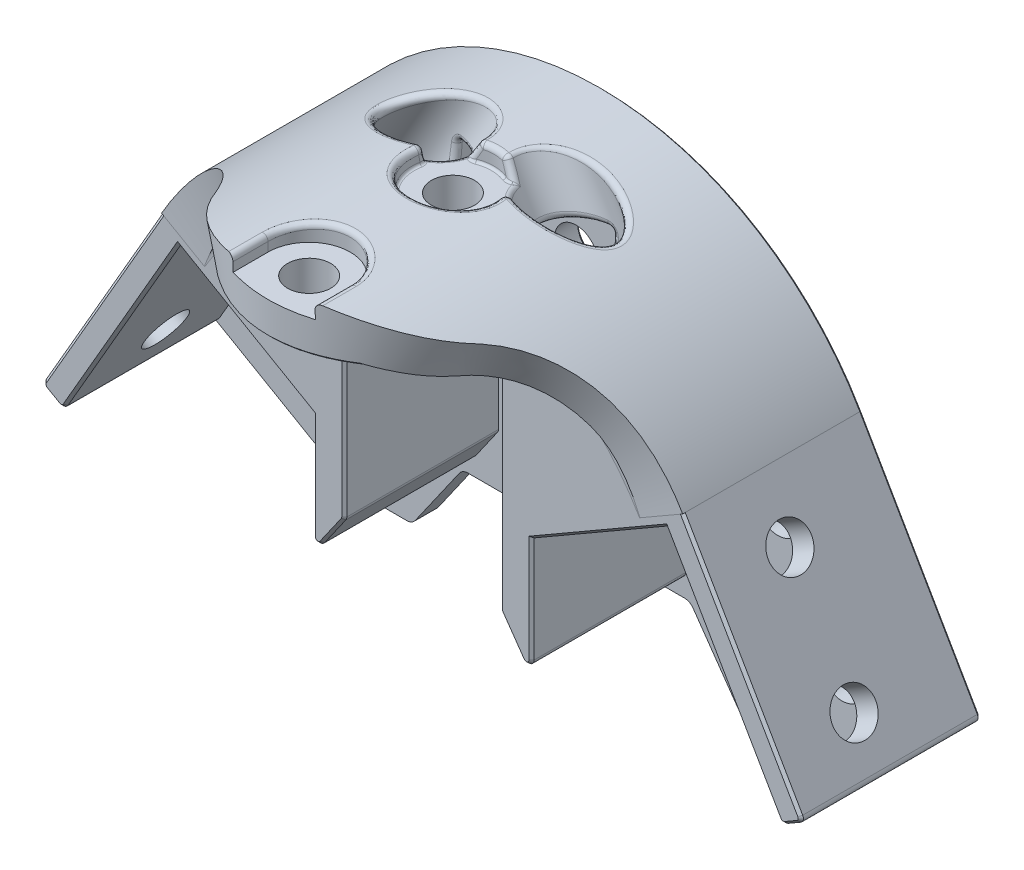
SolidWorks part; units mm, degrees
ref_plane "Płaszczyzna przednia" through (0, 0, 0) normal (0, 0, 1) x (1, 0, 0)
ref_plane "Płaszczyzna górna" through (0, 0, 0) normal (0, 1, 0) x (1, 0, 0)
ref_plane "Płaszczyzna prawa" through (0, 0, 0) normal (1, 0, 0) x (0, 0, -1)
sketch "Szkic2" plane through (0, 0, 0) normal (0, 0, 1) x (1, 0, 0)
  line L0 (0, 48.5816) -> (0, 18.2816) construction
  line L1 (-15.15, 48.5816) -> (15.15, 48.5816)
  line L2 (-15.15, 48.5816) -> (-15.15, 18.2816)
  line L3 (-15.15, 18.2816) -> (15.15, 18.2816)
  line L4 (15.15, 48.5816) -> (15.15, 18.2816)
  line L5 (0, 18.2816) -> (0, 10.2816) construction
  line L6 (0, 10.2816) -> (0, 0) construction
  line L8 (-74.1045, -11.1896) -> (-50.7331, 29.2908)
  line L9 (0, 48.5816) -> (0, 281.3446) construction
  line L10 (74.1045, -11.1896) -> (50.7331, 29.2908)
  line L12 (74.1045, -11.1896) -> (69.9476, -13.5896)
  line L13 (69.9476, -13.5896) -> (47.4476, 25.3816)
  line L14 (-74.1045, -11.1896) -> (-69.9476, -13.5896)
  line L16 (-69.9476, -13.5896) -> (-47.4476, 25.3816)
  line L17 (-47.4476, 25.3816) -> (-21.2936, 10.2816)
  line L20 (47.4476, 25.3816) -> (21.2936, 10.2816)
  line L27 (-21.2936, 10.2816) -> (21.2936, 10.2816)
  arc A0 (-50.7331, 29.2908) -> (50.7331, 29.2908) centre (0, 0) cw
  point P21 (0, 58.5816)
  dimension "D2" = 10
  dimension "D3" = 10
  dimension "D4" = 10
  dimension "D5" = 45
  dimension "D6" = 30.3
  dimension "D7" = 60
  dimension "D8" = 4.8
  dimension "D9" = 4.8
  dimension "D10" = 45
  dimension "D11" = 8
  dimension "D13" = 30.2
extrude "Dodanie-wyciągnięcie1" add sketch "Szkic2" along normal blind 30
sketch "Szkic3" plane through (0, 0, 30) normal (0, 0, 1) x (1, 0, 0)
  line L0 (15.15, 48.5816) -> (-15.15, 48.5816) construction
  line L1 (15.15, 48.5816) -> (-15.15, 48.5816)
  line L2 (-50.7331, 29.2908) -> (-44.0712, 25.4445)
  line L3 (44.0712, 25.4445) -> (50.7331, 29.2908)
  line L4 (-44.0712, 25.4445) -> (0, 0) construction
  line L5 (0, 0) -> (44.0712, 25.4445) construction
  arc A0 (50.7331, 29.2908) -> (-50.7331, 29.2908) centre (0, 0) ccw construction
  arc A1 (50.7331, 29.2908) -> (-50.7331, 29.2908) centre (0, 0) ccw
  arc A2 (-15.15, 48.5816) -> (-44.0712, 25.4445) centre (0, 0) ccw
  arc A3 (15.15, 48.5816) -> (44.0712, 25.4445) centre (0, 0) cw
extrude "Dodanie-wyciągnięcie2" add sketch "Szkic3" along normal blind 30
ref_plane "Płaszczyzna1" through (0, 58.5816, 0) normal (0, 1, 0) x (1, 0, 0)
sketch "Szkic4" plane through (0, 58.5816, 0) normal (0, 1, 0) x (1, 0, 0)
  line L0 (-50.7331, -30) -> (-74.1045, -30) construction
  line L1 (74.1045, -30) -> (50.7331, -30) construction
  line L3 (-50.7331, -60) -> (50.7331, -60) construction
  line L4 (-50.7331, -30) -> (-152.7515, -96.9535)
  line L5 (-152.7515, -96.9535) -> (111.6814, -96.9535)
  line L6 (111.6814, -96.9535) -> (50.7331, -30)
  arc A0 (-50.7331, -30) -> (-25.3666, -45) centre (-50.7331, -58.9488) cw
  arc A1 (50.7331, -30) -> (25.3666, -45) centre (50.7331, -58.9488) ccw
  arc A2 (-25.3666, -45) -> (25.3666, -45) centre (0, -31.0512) ccw
curve "Krzywa18"
ref_plane "Płaszczyzna2" through (0, 50.889, 0) normal (0, -1, 0) x (-1, 0, 0)
sketch "Szkic6" plane through (0, 50.889, 0) normal (0, -1, 0) x (-1, 0, 0)
  line L0 (-47.4476, -30) -> (-69.9476, -30) construction
  line L2 (69.9476, -30) -> (47.4476, -30) construction
  line L3 (-111.6814, -96.9535) -> (-44.0712, -30)
  line L4 (152.7515, -96.9535) -> (-111.6814, -96.9535)
  line L5 (44.0712, -30) -> (152.7515, -96.9535)
  line L9 (15.15, -60) -> (-15.15, -60) construction
  arc A3 (-22.0356, -45) -> (22.0356, -45) centre (0, -36.3144) ccw
  arc A4 (-22.0356, -45) -> (-44.0712, -30) centre (-44.0712, -53.6856) ccw
  arc A5 (44.0712, -30) -> (22.0356, -45) centre (44.0712, -53.6856) ccw
surface "Powierzchnia-Odsunięcie3" parameters "D1"=8
curve "Krzywa20"
surface "Powierzchnia-Wyciągnięcie po profilach2"
surface "Powierzchnia-Wydłuż2" parameters "D1"=2.1, "D2"=2.1
other "Przecięcie1"
sketch "Szkic36" plane through (0, 0, 30) normal (0, 0, 1) x (1, 0, 0)
  line L0 (-45.2565, 24.6508) -> (-44.5129, 25.6995)
  line L1 (-50.7331, 29.2908) -> (-44.0712, 25.4445) construction
  line L2 (-44.5129, 25.6995) -> (-41.1937, 23.9393)
  line L3 (-41.1937, 23.9393) -> (-42.2955, 22.7686)
  line L4 (-42.2955, 22.7686) -> (-45.2565, 24.6508)
  line L5 (44.2071, 25.2378) -> (41.6329, 23.9393)
  line L6 (41.6329, 23.9393) -> (42.293, 22.7214)
  line L7 (42.293, 22.7214) -> (44.9414, 24.2725)
  line L8 (44.9414, 24.2725) -> (44.2071, 25.2378)
extrude "Wytnij-wyciągnięcie9" cut sketch "Szkic36" against normal blind 1
sketch "Szkic37" plane through (0, 0, 29) normal (0, 0, 1) x (1, 0, 0)
  line L4 (44.9414, 24.2725) -> (44.2071, 25.2378)
  line L5 (44.2071, 25.2378) -> (41.6329, 23.9393)
  line L6 (41.6329, 23.9393) -> (42.293, 22.7214)
  line L7 (42.293, 22.7214) -> (44.9414, 24.2725)
  line L8 (44.9414, 24.2725) -> (44.2071, 25.2378)
  line L9 (44.2071, 25.2378) -> (41.6329, 23.9393)
  line L10 (41.6329, 23.9393) -> (42.293, 22.7214)
  line L11 (42.293, 22.7214) -> (44.9414, 24.2725)
  line L12 (-45.2565, 24.6508) -> (-42.2955, 22.7686)
  line L13 (-42.2955, 22.7686) -> (-41.1937, 23.9393)
  line L14 (-41.1937, 23.9393) -> (-44.5129, 25.6995)
  line L15 (-44.5129, 25.6995) -> (-45.2565, 24.6508)
  line L16 (-45.2565, 24.6508) -> (-42.2955, 22.7686)
  line L17 (-42.2955, 22.7686) -> (-41.1937, 23.9393)
  line L18 (-41.1937, 23.9393) -> (-44.5129, 25.6995)
  line L19 (-44.5129, 25.6995) -> (-45.2565, 24.6508)
  dimension "D1" = 0
  dimension "D2" = 0
extrude "Dodanie-wyciągnięcie5" add sketch "Szkic37" along normal blind 1
sketch "Szkic7" plane through (0, 0, 0) normal (0, 0, -1) x (-1, 0, 0)
  line L0 (-21.2936, 10.2816) -> (-43.7936, -28.6896)
  line L2 (-43.7936, -28.6896) -> (-69.9476, -13.5896)
  line L3 (-69.9476, -13.5896) -> (-74.1045, -11.1896) construction
  line L7 (69.9476, -13.5896) -> (43.7936, -28.6896)
  line L9 (69.9476, -13.5896) -> (74.1045, -11.1896)
  line L10 (74.1045, -11.1896) -> (50.7331, 29.2908)
  line L11 (-50.7331, 29.2908) -> (-74.1045, -11.1896)
  line L12 (-74.1045, -11.1896) -> (-69.9476, -13.5896)
  line L13 (-69.9476, -13.5896) -> (-47.4476, 25.3816)
  line L14 (-47.4476, 25.3816) -> (-21.2936, 10.2816)
  line L15 (-21.2936, 10.2816) -> (21.2936, 10.2816)
  line L16 (21.2936, 10.2816) -> (47.4476, 25.3816)
  line L17 (47.4476, 25.3816) -> (69.9476, -13.5896)
  line L18 (69.9476, -13.5896) -> (74.1045, -11.1896)
  line L19 (74.1045, -11.1896) -> (50.7331, 29.2908)
  line L20 (-50.7331, 29.2908) -> (-74.1045, -11.1896)
  line L21 (-74.1045, -11.1896) -> (-69.9476, -13.5896)
  line L24 (-21.2936, 10.2816) -> (21.2936, 10.2816)
  line L27 (43.7936, -28.6896) -> (21.2936, 10.2816)
  arc A1 (50.7331, 29.2908) -> (-50.7331, 29.2908) centre (0, 0) ccw
  arc A3 (50.7331, 29.2908) -> (-50.7331, 29.2908) centre (0, 0) ccw
  dimension "D2" = 35
  dimension "D3" = 35
  dimension "D1" = 0
extrude "Dodanie-wyciągnięcie3" add sketch "Szkic7" along normal blind 4
sketch "Szkic8" plane through (0, 0, 0) normal (0, 0, 1) x (1, 0, 0)
  line L0 (-56.784, -21.1896) -> (-34.284, 17.7816) construction
  line L1 (-43.7936, -28.6896) -> (-69.9476, -13.5896) construction
  line L2 (-47.4476, 25.3816) -> (-21.2936, 10.2816) construction
  line L3 (-21.2936, 10.2816) -> (-43.7936, -28.6896) construction
  line L4 (-15.15, 48.5816) -> (15.15, 18.2816) construction
  line L5 (56.784, -21.1896) -> (34.284, 17.7816) construction
  line L6 (69.9476, -13.5896) -> (43.7936, -28.6896) construction
  line L7 (21.2936, 10.2816) -> (47.4476, 25.3816) construction
  line L8 (43.7936, -28.6896) -> (21.2936, 10.2816) construction
  line L9 (21.2936, 10.2816) -> (47.4476, 25.3816) construction
  point P20 (-39.8236, 128.4719)
  point P21 (-39.284, 9.1213)
  point P22 (-51.784, -12.5293)
  point P23 (39.284, 9.1213)
  point P24 (51.784, -12.5293)
  point P27 (0, 33.4316)
  dimension "D1" = 15
  dimension "D2" = 15
  dimension "D3" = 10
  dimension "D4" = 10
  dimension "D5" = 10
  dimension "D6" = 10
hole_wizard "Otwór pod śrubę M81" positions "Szkic9" profile "Szkic10" hole size "M8" standard "DIN"
sketch "Szkic9" plane through (0, 0, 0) normal (0, 0, 1) x (1, 0, 0)
  point P0 (0, 33.4316)
  point P3 (-39.284, 9.1213)
  point P6 (-51.784, -12.5293)
  point P9 (39.284, 9.1213)
  point P12 (51.784, -12.5293)
sketch "Szkic10" plane through (0, 33.4316, 0) normal (1, 0, 0) x (0, -1, 0)
  line L0 (0, 0) -> (0, 4)
  line L1 (0, 4) -> (4.2, 4)
  line L2 (4.2, 4) -> (4.2, 0)
  line L5 (4.2, 0) -> (0, 0)
  line L11 (0, -6.35) -> (0, 107.95) construction
  dimension "Średnica otworu na wylot" = 8.4
  dimension "Głębokość otworu na wylot" = 4
sketch "Szkic11" plane through (-46.5762, 26.8908, 0) normal (0.866, -0.5, 0) x (0, 0, -1)
  line L0 (-15, -1.7427) -> (-15, -46.7427) construction
  line L1 (-30, -1.7427) -> (0, -1.7427) construction
  line L2 (-30, -46.7427) -> (0, -46.7427) construction
  line L3 (-30, -1.7427) -> (0, -1.7427) construction
  point P6 (-15, -11.7427)
  point P7 (-15, -36.7427)
  dimension "D1" = 10
  dimension "D2" = 10
hole_wizard "Otwór pod śrubę M82" positions "Szkic12" profile "Szkic13" hole size "M8" standard "DIN"
sketch "Szkic12" plane through (-46.5762, 26.8908, 0) normal (0.866, -0.5, 0) x (0, 0, -1)
  point P0 (-15, -11.7427)
  point P3 (-15, -36.7427)
sketch "Szkic13" plane through (-52.4476, 16.7213, 15) normal (0, 0, 1) x (0.5, 0.866, 0)
  line L0 (0, 0) -> (0, 39.6856)
  line L1 (0, 39.6856) -> (4.2, 39.6856)
  line L2 (4.2, 39.6856) -> (4.2, 0)
  line L5 (4.2, 0) -> (0, 0)
  line L11 (0, -6.35) -> (0, 107.95) construction
  dimension "Średnica otworu na wylot" = 8.4
  dimension "Głębokość otworu na wylot" = 39.6856
sketch "Szkic14" plane through (46.5762, 26.8908, 0) normal (-0.866, -0.5, 0) x (0, 0, 1)
  line L0 (15, -1.7427) -> (15, -46.7427) construction
  line L1 (30, -1.7427) -> (0, -1.7427) construction
  line L2 (30, -46.7427) -> (0, -46.7427) construction
  point P6 (15, -11.7427)
  point P7 (15, -36.7427)
  dimension "D1" = 10
  dimension "D2" = 10
hole_wizard "Otwór pod śrubę M83" positions "Szkic15" profile "Szkic16" hole size "M8" standard "DIN"
sketch "Szkic15" plane through (46.5762, 26.8908, 0) normal (-0.866, -0.5, 0) x (0, 0, 1)
  point P0 (15, -11.7427)
  point P3 (15, -36.7427)
sketch "Szkic16" plane through (52.4476, 16.7213, 15) normal (0, 0, 1) x (0.5, -0.866, 0)
  line L0 (0, 0) -> (0, 39.6856)
  line L1 (0, 39.6856) -> (4.2, 39.6856)
  line L2 (4.2, 39.6856) -> (4.2, 0)
  line L5 (4.2, 0) -> (0, 0)
  line L11 (0, -6.35) -> (0, 107.95) construction
  dimension "Średnica otworu na wylot" = 8.4
  dimension "Głębokość otworu na wylot" = 39.6856
sketch "Szkic17" plane through (0, 18.2816, 0) normal (0, 1, 0) x (1, 0, 0)
  line L0 (-15.15, 0) -> (15.15, -30)
  point P4 (0, -15)
hole_wizard "Otwór pod śrubę M84" positions "Szkic20" profile "Szkic21" hole size "M8" standard "DIN"
sketch "Szkic20" plane through (0, 18.2816, 0) normal (0, 1, 0) x (1, 0, 0)
  point P0 (0, -15)
sketch "Szkic21" plane through (0, 18.2816, 15) normal (1, 0, 0) x (0, 0, 1)
  line L0 (0, 0) -> (0, 46.9711)
  line L1 (0, 46.9711) -> (4.2, 46.9711)
  line L2 (4.2, 46.9711) -> (4.2, 0)
  line L5 (4.2, 0) -> (0, 0)
  line L11 (0, -6.35) -> (0, 107.95) construction
  dimension "Średnica otworu na wylot" = 8.4
  dimension "Głębokość otworu na wylot" = 46.9711
sketch "Szkic38" plane through (0, 48.5816, 0) normal (0, -1, 0) x (1, 0, 0)
  line L0 (0, 52) -> (0, 24)
  line L1 (-48.3329, 60) -> (51.7441, 60) construction
  spline S0 degree 3 poles (-1281.8202, 1578.8529) (185.3728, -818.5402) (-121.0759, -4.4194) (-10.5468, 57.4983) (-9.3105, 58.0736) (-7.3727, 58.7856) (-6.7193, 58.9954) (-5.4068, 59.3564) (-4.7462, 59.5082) (-2.7511, 59.8741) (-1.403, 59.9978) (0.6466, 60.0011) (1.3383, 59.9699) (2.7049, 59.8457) (3.3813, 59.7531) (5.391, 59.3886) (6.7047, 59.0298) (8.6369, 58.3215) (9.2754, 58.0566) (10.5199, 57.4815) (11.1287, 57.1705) (118.6979, -2.974) (-185.8037, -776.5369) (1303.6672, 1561.7558) knots -11.391048 -11.391048 -11.391048 -11.391048 0.125 0.125 0.25 0.25 0.3125 0.3125 0.375 0.375 0.5 0.5 0.5625 0.5625 0.625 0.625 0.75 0.75 0.8125 0.8125 0.875 0.875 12.094098 12.094098 12.094098 12.094098 only from (-15.15, 54.5778) to (15.15, 54.5776) construction
  spline S1 degree 3 poles (-15.15, 54.5778) (-14.0583, 55.415) (-12.9205, 56.1686) (-10.5468, 57.4983) (-9.3105, 58.0736) (-7.3727, 58.7856) (-6.7193, 58.9954) (-5.4068, 59.3564) (-4.7462, 59.5082) (-2.7511, 59.8741) (-1.403, 59.9978) (0.6466, 60.0011) (1.3383, 59.9699) (2.7049, 59.8457) (3.3813, 59.7531) (5.391, 59.3886) (6.7047, 59.0298) (8.6369, 58.3215) (9.2754, 58.0566) (10.5199, 57.4815) (11.1287, 57.1705) (12.9165, 56.1709) (14.0572, 55.4159) (15.15, 54.5776) knots 0 0 0 0 0.125 0.125 0.25 0.25 0.3125 0.3125 0.375 0.375 0.5 0.5 0.5625 0.5625 0.625 0.625 0.75 0.75 0.8125 0.8125 0.875 0.875 1 1 1 1
  dimension "D1" = 8
  dimension "D2" = 28
hole_wizard "Otwór pod śrubę M88" positions "Szkic39" profile "Szkic40" hole size "M8" standard "DIN"
sketch "Szkic39" plane through (0, 48.5816, 0) normal (0, -1, 0) x (-1, 0, 0)
  point P0 (0, -52)
  point P3 (0, -24)
sketch "Szkic40" plane through (0, 48.5816, 52) normal (1, 0, 0) x (0, 0, -1)
  line L0 (0, 0) -> (0, 10)
  line L1 (0, 10) -> (4.2, 10)
  line L2 (4.2, 10) -> (4.2, 0)
  line L5 (4.2, 0) -> (0, 0)
  line L11 (0, -6.35) -> (0, 107.95) construction
  dimension "Średnica otworu na wylot" = 8.4
  dimension "Głębokość otworu na wylot" = 10
ref_plane "Płaszczyzna3" through (0, 55.0816, 0) normal (0, -1, 0) x (-1, 0, 0)
sketch "Szkic41" plane through (0, 55.0816, 0) normal (0, -1, 0) x (-1, 0, 0)
  line L0 (0, -52) -> (0, -59.9999) construction
  line L1 (8, -52) -> (8, -59.9999)
  line L2 (-8, -52) -> (-8, -59.9999)
  circle A0 centre (0, -24) radius 8
  arc A1 (8, -52) -> (-8, -52) centre (0, -52) ccw
  arc A2 (-8, -59.9999) -> (8, -59.9999) centre (0, -59.9999) ccw
  spline S0 degree 3 number of poles 90 (50.7331, -30) -> (-50.7331, -30) construction
  point P9 (0, -56)
  dimension "D1" = 16
extrude "Wytnij-wyciągnięcie11" cut sketch "Szkic41" against normal through all
sketch "Szkic25" plane through (-0.8713, -1.5092, 0) normal (-0.5, -0.866, 0) x (0.866, -0.5, 0)
  line L0 (-53.5816, 30) -> (-53.5816, 0) construction
  line L1 (-53.7816, 30) -> (-23.5816, 30) construction
  line L2 (-53.7816, 0) -> (-23.5816, 0) construction
  line L4 (-23.5816, 30) -> (-23.5816, 0) construction
  line L5 (-53.5816, 30) -> (-23.5816, 0) construction
  point P8 (-38.5816, 15)
  dimension "D1" = 30
sketch "Szkic26" plane through (0.8713, -1.5092, 0) normal (0.5, -0.866, 0) x (0.866, 0.5, 0)
  line L0 (53.5816, 30) -> (53.5816, 0) construction
  line L1 (23.5816, 30) -> (53.7816, 30) construction
  line L2 (23.5816, 0) -> (53.7816, 0) construction
  line L3 (23.5816, 30) -> (23.5816, 0) construction
  line L4 (53.5816, 30) -> (23.5816, 0)
  point P8 (38.5816, 15)
  dimension "D1" = 30
hole_wizard "Otwór pod śrubę M86" positions "Szkic27" profile "Szkic28" hole size "M8" standard "DIN"
sketch "Szkic27" plane through (0.8713, -1.5092, 0) normal (0.5, -0.866, 0) x (-0.866, -0.5, 0)
  point P0 (-38.5816, -15)
sketch "Szkic28" plane through (34.284, 17.7816, 15) normal (0, 0, 1) x (0.866, 0.5, 0)
  line L0 (0, 0) -> (0, 89.5281)
  line L1 (0, 89.5281) -> (4.2, 89.5281)
  line L2 (4.2, 89.5281) -> (4.2, 0)
  line L5 (4.2, 0) -> (0, 0)
  line L11 (0, -6.35) -> (0, 107.95) construction
  dimension "Średnica otworu na wylot" = 8.4
  dimension "Głębokość otworu na wylot" = 89.5281
hole_wizard "Otwór pod śrubę M87" positions "Szkic29" profile "Szkic30" hole size "M8" standard "DIN"
sketch "Szkic29" plane through (-0.8713, -1.5092, 0) normal (-0.5, -0.866, 0) x (-0.866, 0.5, 0)
  point P0 (38.5816, -15)
sketch "Szkic30" plane through (-34.284, 17.7816, 15) normal (0, 0, 1) x (0.866, -0.5, 0)
  line L0 (0, 0) -> (0, 89.5281)
  line L1 (0, 89.5281) -> (4.2, 89.5281)
  line L2 (4.2, 89.5281) -> (4.2, 0)
  line L5 (4.2, 0) -> (0, 0)
  line L11 (0, -6.35) -> (0, 107.95) construction
  dimension "Średnica otworu na wylot" = 8.4
  dimension "Głębokość otworu na wylot" = 89.5281
ref_plane "Płaszczyzna4" through (3.1287, 5.419, 0) normal (-0.5, -0.866, 0) x (-0.866, 0.5, 0)
ref_plane "Płaszczyzna5" through (-3.1287, 5.419, 0) normal (0.5, -0.866, 0) x (-0.866, -0.5, 0)
sketch "Szkic31" plane through (3.1287, 5.419, 0) normal (-0.5, -0.866, 0) x (-0.866, 0.5, 0)
  circle A0 centre (38.5816, -15) radius 7
  dimension "D1" = 14
extrude "Wytnij-wyciągnięcie3" cut sketch "Szkic31" against normal through all
sketch "Szkic32" plane through (-3.1287, 5.419, 0) normal (0.5, -0.866, 0) x (-0.866, -0.5, 0)
  circle A0 centre (-38.5816, -15) radius 7
  dimension "D1" = 14
extrude "Wytnij-wyciągnięcie4" cut sketch "Szkic32" against normal through all
sketch "Szkic33" plane through (0, 0, 0) normal (0, 0, 1) x (1, 0, 0)
  line L0 (-15.15, 18.2816) -> (15.15, 18.2816) construction
  line L1 (-15.15, 18.2816) -> (15.15, 18.2816)
  line L2 (-15.15, 18.2816) -> (-15.15, 10.2816)
  line L3 (-15.15, 10.2816) -> (15.15, 10.2816)
  line L4 (15.15, 18.2816) -> (15.15, 10.2816)
  line L5 (-21.2936, 10.2816) -> (21.2936, 10.2816) construction
  line L6 (0, 18.2816) -> (0, 33.4316) construction
  dimension "D1" = 30.3
extrude "Wytnij-wyciągnięcie7" cut sketch "Szkic33" against normal through all both and the other way through all
sketch "Szkic42" plane through (0, 0, -4) normal (0, 0, -1) x (-1, 0, 0)
  line L0 (15.15, 10.2816) -> (15.15, -4.7184)
  line L1 (15.15, -4.7184) -> (31.9348, -28.6896)
  line L2 (31.9348, -28.6896) -> (43.7936, -28.6896)
  line L3 (43.7936, -28.6896) -> (21.2936, 10.2816)
  line L4 (21.2936, 10.2816) -> (15.15, 10.2816)
  line L5 (0, 33.4316) -> (0, -49.4461) construction
  line L6 (-21.2936, 10.2816) -> (-15.15, 10.2816)
  line L7 (-43.7936, -28.6896) -> (-21.2936, 10.2816)
  line L8 (-31.9348, -28.6896) -> (-43.7936, -28.6896)
  line L9 (-15.15, -4.7184) -> (-31.9348, -28.6896)
  line L10 (-15.15, 10.2816) -> (-15.15, -4.7184)
  dimension "D1" = 145
  dimension "D2" = 15
extrude "Dodanie-wyciągnięcie6" add sketch "Szkic42" against normal up to surface (4 mm away)
sketch "Szkic43" plane through (0, 0, 0) normal (0, 0, 1) x (1, 0, 0)
  line L0 (15.15, 10.2816) -> (21.2936, 10.2816) construction
  line L1 (-15.15, 10.2816) -> (-21.2936, 10.2816) construction
  line L2 (15.15, 10.2816) -> (21.2936, 10.2816)
  line L3 (-15.15, 10.2816) -> (-21.2936, 10.2816)
  line L4 (-15.15, 10.2816) -> (-15.15, -4.7184)
  line L5 (-15.15, -4.7184) -> (-21.2936, -13.4924)
  line L6 (-31.9348, -28.6896) -> (-15.15, -4.7184) construction
  line L7 (-21.2936, -13.4924) -> (-21.2936, 10.2816)
  line L8 (15.15, 10.2816) -> (15.15, -4.7184)
  line L9 (15.15, -4.7184) -> (21.2936, -13.4924)
  line L10 (15.15, -4.7184) -> (31.9348, -28.6896) construction
  line L11 (21.2936, -13.4924) -> (21.2936, 10.2816)
extrude "Dodanie-wyciągnięcie7" add sketch "Szkic43" along normal up to surface (30 mm away)
sketch "Szkic44" plane through (15.15, 0, 0) normal (-1, 0, 0) x (0, 0, 1)
  circle A2 centre (22.3426, 7.3116) radius 2.5
  circle A3 centre (22.3426, 7.3116) radius 7.5
sketch "Szkic45" plane through (0, 0, -4) normal (0, 0, -1) x (-1, 0, 0)
  line L0 (15.15, -4.7184) -> (15.15, 18.2816) construction
  line L1 (15.15, 18.2816) -> (-15.15, 18.2816) construction
  line L2 (-15.15, 18.2816) -> (-15.15, -4.7184) construction
  line L3 (15.15, -4.7184) -> (15.15, 18.2816)
  line L4 (15.15, 18.2816) -> (-15.15, 18.2816)
  line L5 (-15.15, 18.2816) -> (-15.15, -4.7184)
  line L8 (-22.1521, -14.7184) -> (22.1521, -14.7184)
  line L9 (-31.9348, -28.6896) -> (-15.15, -4.7184) construction
  line L10 (15.15, -4.7184) -> (31.9348, -28.6896) construction
  line L11 (15.15, -4.7184) -> (22.1521, -14.7184)
  line L12 (-22.1521, -14.7184) -> (-15.15, -4.7184)
  dimension "D1" = 33
extrude "Dodanie-wyciągnięcie8" add sketch "Szkic45" against normal up to surface (4 mm away)
sketch "Szkic49" plane through (0, 0, -4) normal (0, 0, -1) x (-1, 0, 0)
  line L120 (-5.1, 47.6816) -> (-5.1, 48.4316)
  line L121 (-5.1, 48.4316) -> (-13, 48.4316)
  line L122 (-15, 46.4316) -> (-15, 38.5316)
  line L123 (-15, 38.5316) -> (-14.25, 38.5316)
  line L124 (-14.25, 38.5316) -> (-14.25, 37.5316)
  line L125 (-14.25, 37.5316) -> (-13.5, 37.5316)
  line L126 (-13.5, 37.5316) -> (-13.5, 41.1816)
  line L127 (-13, 41.6816) -> (-9.5178, 41.6816)
  line L128 (-9.1642, 41.5351) -> (-5.9464, 38.3174)
  line L129 (-5.8, 37.9638) -> (-5.8, 28.8994)
  line L130 (-5.9464, 28.5458) -> (-9.1642, 25.328)
  line L131 (-9.5178, 25.1816) -> (-13, 25.1816)
  line L132 (-13.5, 25.6816) -> (-13.5, 29.3316)
  line L133 (-13.5, 29.3316) -> (-14.25, 29.3316)
  line L134 (-14.25, 29.3316) -> (-14.25, 28.3316)
  line L135 (-14.25, 28.3316) -> (-15, 28.3316)
  line L136 (-15, 28.3316) -> (-15, 20.4316)
  line L137 (-13, 18.4316) -> (-5.1, 18.4316)
  line L138 (-5.1, 18.4316) -> (-5.1, 19.1816)
  line L139 (-5.1, 19.1816) -> (-4.1, 19.1816)
  line L140 (-4.1, 19.1816) -> (-4.1, 19.9316)
  line L141 (-4.1, 19.9316) -> (-7.75, 19.9316)
  line L142 (-8.25, 20.4316) -> (-8.25, 23.9138)
  line L143 (-8.1036, 24.2674) -> (-4.8858, 27.4851)
  line L144 (-4.5322, 27.6316) -> (4.5322, 27.6316)
  line L145 (4.8858, 27.4851) -> (8.1036, 24.2674)
  line L146 (8.25, 23.9138) -> (8.25, 20.4316)
  line L147 (7.75, 19.9316) -> (4.1, 19.9316)
  line L148 (4.1, 19.9316) -> (4.1, 19.1816)
  line L149 (4.1, 19.1816) -> (5.1, 19.1816)
  line L150 (5.1, 19.1816) -> (5.1, 18.4316)
  line L151 (5.1, 18.4316) -> (13, 18.4316)
  line L152 (15, 20.4316) -> (15, 28.3316)
  line L153 (15, 28.3316) -> (14.25, 28.3316)
  line L154 (14.25, 28.3316) -> (14.25, 29.3316)
  line L155 (14.25, 29.3316) -> (13.5, 29.3316)
  line L156 (13.5, 29.3316) -> (13.5, 25.6816)
  line L157 (13, 25.1816) -> (9.5178, 25.1816)
  line L158 (9.1642, 25.328) -> (5.9464, 28.5458)
  line L159 (5.8, 28.8994) -> (5.8, 37.9638)
  line L160 (5.9464, 38.3174) -> (9.1642, 41.5351)
  line L161 (9.5178, 41.6816) -> (13, 41.6816)
  line L162 (13.5, 41.1816) -> (13.5, 37.5316)
  line L163 (13.5, 37.5316) -> (14.25, 37.5316)
  line L164 (14.25, 37.5316) -> (14.25, 38.5316)
  line L165 (14.25, 38.5316) -> (15, 38.5316)
  line L166 (15, 38.5316) -> (15, 46.4316)
  line L167 (13, 48.4316) -> (5.1, 48.4316)
  line L168 (5.1, 48.4316) -> (5.1, 47.6816)
  line L169 (5.1, 47.6816) -> (4.1, 47.6816)
  line L170 (4.1, 47.6816) -> (4.1, 46.9316)
  line L171 (4.1, 46.9316) -> (7.75, 46.9316)
  line L172 (8.25, 46.4316) -> (8.25, 42.9494)
  line L173 (8.1036, 42.5958) -> (4.8858, 39.378)
  line L174 (4.5322, 39.2316) -> (-4.5322, 39.2316)
  line L175 (-4.8858, 39.378) -> (-8.1036, 42.5958)
  line L176 (-8.25, 42.9494) -> (-8.25, 46.4316)
  line L177 (-7.75, 46.9316) -> (-4.1, 46.9316)
  line L178 (-4.1, 46.9316) -> (-4.1, 47.6816)
  line L179 (-4.1, 47.6816) -> (-5.1, 47.6816)
  arc A56 (-13, 48.4316) -> (-15, 46.4316) centre (-13, 46.4316) ccw
  arc A57 (-13, 41.6816) -> (-13.5, 41.1816) centre (-13, 41.1816) ccw
  arc A58 (-9.1642, 41.5351) -> (-9.5178, 41.6816) centre (-9.5178, 41.1816) ccw
  arc A59 (-5.8, 37.9638) -> (-5.9464, 38.3174) centre (-6.3, 37.9638) ccw
  arc A60 (-5.9464, 28.5458) -> (-5.8, 28.8994) centre (-6.3, 28.8994) ccw
  arc A61 (-9.5178, 25.1816) -> (-9.1642, 25.328) centre (-9.5178, 25.6816) ccw
  arc A62 (-13.5, 25.6816) -> (-13, 25.1816) centre (-13, 25.6816) ccw
  arc A63 (-15, 20.4316) -> (-13, 18.4316) centre (-13, 20.4316) ccw
  arc A64 (-8.25, 20.4316) -> (-7.75, 19.9316) centre (-7.75, 20.4316) ccw
  arc A65 (-8.1036, 24.2674) -> (-8.25, 23.9138) centre (-7.75, 23.9138) ccw
  arc A66 (-4.5322, 27.6316) -> (-4.8858, 27.4851) centre (-4.5322, 27.1316) ccw
  arc A67 (4.8858, 27.4851) -> (4.5322, 27.6316) centre (4.5322, 27.1316) ccw
  arc A68 (8.25, 23.9138) -> (8.1036, 24.2674) centre (7.75, 23.9138) ccw
  arc A69 (7.75, 19.9316) -> (8.25, 20.4316) centre (7.75, 20.4316) ccw
  arc A70 (13, 18.4316) -> (15, 20.4316) centre (13, 20.4316) ccw
  arc A71 (13, 25.1816) -> (13.5, 25.6816) centre (13, 25.6816) ccw
  arc A72 (9.1642, 25.328) -> (9.5178, 25.1816) centre (9.5178, 25.6816) ccw
  arc A73 (5.8, 28.8994) -> (5.9464, 28.5458) centre (6.3, 28.8994) ccw
  arc A74 (5.9464, 38.3174) -> (5.8, 37.9638) centre (6.3, 37.9638) ccw
  arc A75 (9.5178, 41.6816) -> (9.1642, 41.5351) centre (9.5178, 41.1816) ccw
  arc A76 (13.5, 41.1816) -> (13, 41.6816) centre (13, 41.1816) ccw
  arc A77 (15, 46.4316) -> (13, 48.4316) centre (13, 46.4316) ccw
  arc A78 (8.25, 46.4316) -> (7.75, 46.9316) centre (7.75, 46.4316) ccw
  arc A79 (8.1036, 42.5958) -> (8.25, 42.9494) centre (7.75, 42.9494) ccw
  arc A80 (4.5322, 39.2316) -> (4.8858, 39.378) centre (4.5322, 39.7316) ccw
  arc A81 (-4.8858, 39.378) -> (-4.5322, 39.2316) centre (-4.5322, 39.7316) ccw
  arc A82 (-8.25, 42.9494) -> (-8.1036, 42.5958) centre (-7.75, 42.9494) ccw
  arc A83 (-7.75, 46.9316) -> (-8.25, 46.4316) centre (-7.75, 46.4316) ccw
sketch "Szkic50" plane through (0, 0, -4) normal (0, 0, -1) x (-1, 0, 0)
  circle A1 centre (0, 7.3316) radius 2.7
  dimension "D1" = 5.4
extrude "Wytnij-wyciągnięcie14" cut sketch "Szkic50" against normal through all
sketch "Szkic51" plane through (0, 0, -4) normal (0, 0, -1) x (-1, 0, 0)
  line L9 (-22.1521, -14.7184) -> (22.1521, -14.7184)
  line L10 (22.1521, -14.7184) -> (31.9348, -28.6896)
  line L11 (31.9348, -28.6896) -> (43.7936, -28.6896)
  line L12 (43.7936, -28.6896) -> (74.1045, -11.1896)
  line L13 (74.1045, -11.1896) -> (50.7331, 29.2908)
  line L14 (-50.7331, 29.2908) -> (-74.1045, -11.1896)
  line L15 (-74.1045, -11.1896) -> (-43.7936, -28.6896)
  line L16 (-43.7936, -28.6896) -> (-31.9348, -28.6896)
  line L17 (-31.9348, -28.6896) -> (-22.1521, -14.7184)
  line L18 (-22.1521, -14.7184) -> (22.1521, -14.7184)
  line L19 (22.1521, -14.7184) -> (31.9348, -28.6896)
  line L20 (31.9348, -28.6896) -> (43.7936, -28.6896)
  line L21 (43.7936, -28.6896) -> (74.1045, -11.1896)
  line L22 (74.1045, -11.1896) -> (50.7331, 29.2908)
  line L23 (-50.7331, 29.2908) -> (-74.1045, -11.1896)
  line L24 (-74.1045, -11.1896) -> (-43.7936, -28.6896)
  line L25 (-43.7936, -28.6896) -> (-31.9348, -28.6896)
  line L26 (-31.9348, -28.6896) -> (-22.1521, -14.7184)
  arc A1 (50.7331, 29.2908) -> (-50.7331, 29.2908) centre (0, 0) ccw
  arc A2 (50.7331, 29.2908) -> (-50.7331, 29.2908) centre (0, 0) ccw
  circle A3 centre (-51.784, -12.5293) radius 4.2
  circle A4 centre (-51.784, -12.5293) radius 4.2
  circle A5 centre (-39.284, 9.1213) radius 4.2
  circle A6 centre (-39.284, 9.1213) radius 4.2
  circle A7 centre (51.784, -12.5293) radius 4.2
  circle A8 centre (51.784, -12.5293) radius 4.2
  circle A9 centre (39.284, 9.1213) radius 4.2
  circle A10 centre (39.284, 9.1213) radius 4.2
  circle A11 centre (0, 33.4316) radius 4.2
  circle A12 centre (0, 33.4316) radius 4.2
  circle A13 centre (0, 7.3316) radius 2.7
  circle A14 centre (0, 7.3316) radius 2.7
  dimension "D1" = 0
  dimension "D2" = 0
  dimension "D3" = 0
  dimension "D4" = 0
  dimension "D5" = 0
  dimension "D6" = 0
  dimension "D7" = 0
extrude "Dodanie-wyciągnięcie9" add sketch "Szkic51" along normal blind 1
fillet "Zaokrąglenie1" radius 1 10 edges at (-15.15, 48.5816, 4.0493) (15.15, 48.5816, 4.0493) (74.1045, -11.1896, 12.5) (69.9476, -13.5896, 15) (-15.15, -4.7184, 15) (15.15, -4.7184, 15) (21.2936, -13.4924, 15) (-21.2936, -13.4924, 15) (-69.9476, -13.5896, 15) (-74.1045, -11.1896, 12.5)
fillet "Zaokrąglenie2" radius 1 13 edges at (-8, 58.0328, 55.4362) (8, 58.0328, 55.4362) (8.435, 48.5816, 15.4449) (14.7692, 48.3668, 8.1871) (-15.15, 36.9319, 15.2553) (-14.9406, 48.1939, 8.1728) (0.9129, 58.5745, 31.9477) (0.9129, 58.5745, 31.9477) (0.9129, 58.5745, 59.9477) (-4.0419, 58.442, 18.8286) (4.9396, 58.373, 19.7763) (15.15, 36.9319, 15.2553) (-8.435, 48.5816, 15.4449)
fillet "Zaokrąglenie3" radius 1 8 edges at (2.7371, 58.362, 15.9763) (-2.7349, 58.3632, 15.9737) (-7.891, 57.6515, 21.4431) (7.8862, 57.6486, 21.4385) (4.538, 56.1602, 17.4116) (-4.7761, 55.878, 17.5821) (-7.0588, 55.6434, 20.2352) (7.0623, 55.6523, 20.2418)
fillet "Zaokrąglenie4" radius 1 2 edges at (6.1334, 55.0816, 19.0221) (-6.1334, 55.0816, 19.0221)
fillet "Zaokrąglenie5" radius 0.5 10 edges at (-4.5791, 55.0228, 16.4136) (-3.6501, 55.0816, 16.7634) (4.5791, 55.0228, 16.4136) (3.8497, 55.0816, 16.7573) (8.5228, 54.9161, 21.2052) (7.8359, 55.0816, 22.0818) (-8.5228, 54.9161, 21.2052) (-7.8742, 55.0816, 21.9121) (0, 55.0816, 16) (0, 55.0816, 32)
fillet "Zaokrąglenie6" radius 2 11 edges at (43.7936, -28.6896, -2.5) (-43.7936, -28.6896, -2.5) (-31.7902, 39.7376, 30) (31.7902, 39.7376, 30) (44.0712, 25.4445, 30.0007) (-44.0712, 25.4445, 30.0007) (-31.9348, -28.6896, -2.5) (31.9348, -28.6896, -2.5) (-22.1521, -14.7184, -2.5) (22.1521, -14.7184, -2.5) (29.8992, 41.1792, 34.8528)
chamfer "Sfazowanie1" distance 0.5 angle 45 56 edges at (15.15, 48.5816, 43.2888) (-15.15, 48.5816, 43.2889) (-15.15, 48.5816, 27.4971) (15.15, 48.5816, 27.4971) (-34.3706, 17.8316, 30) (34.3706, 17.8316, 30) (21.2936, -0.0196, 30) (58.4476, 6.329, 30) (0, 58.5816, -5) (62.1688, 9.4836, -5) (47.584, -12.5293, -5) (35.084, 9.1213, -5) (-55.984, -12.5293, -5) (-43.484, 9.1213, -5) (-4.2, 33.4316, -5) (-2.7, 7.3316, -5) (15.15, 21.0396, 30) (-62.1688, 9.4836, -5) (58.7481, -20.0556, -5) (-73.7044, -11.0824, -5) (73.7044, -11.0824, -5) (72.026, -12.3896, 30) (17.4026, -7.9355, 30) (20.5943, -11.2745, 30) (15.1963, -4.7038, 30) (70.0548, -13.1895, 30) (73.7044, -11.0824, 30) (-17.4026, -7.9355, 30) (-21.2936, -0.0196, 30) (-72.026, -12.3896, 30) (-58.4476, 6.329, 30) (-73.7044, -11.0824, 30) (-70.0548, -13.1895, 30) (-20.5943, -11.2745, 30) (-15.1963, -4.7038, 30) (1.1917, 48.5816, 59.9679) (38.1168, -28.6896, -5) (27.0434, -21.704, -5) (0, -14.7184, -5) (-27.0434, -21.704, -5) (-38.1168, -28.6896, -5) (-58.7481, -20.0556, -5) (-43.7753, -28.6214, -5) (32.0524, -28.4636, -5) (-32.0524, -28.4636, -5) (43.7753, -28.6214, -5) (25.6005, 43.9808, 32) (-15.15, 21.0396, 30) (-30.7842, 37.9799, 30) (22.0344, -14.9444, -5) (-22.0344, -14.9444, -5) (15.15, 47.8457, 30.4784) (-15.15, 48.1573, 30.7936)
fillet "Zaokrąglenie7" radius 1 6 edges at (-15.2868, 48.7091, 22.4914) (15.2868, 48.7091, 22.4914)
